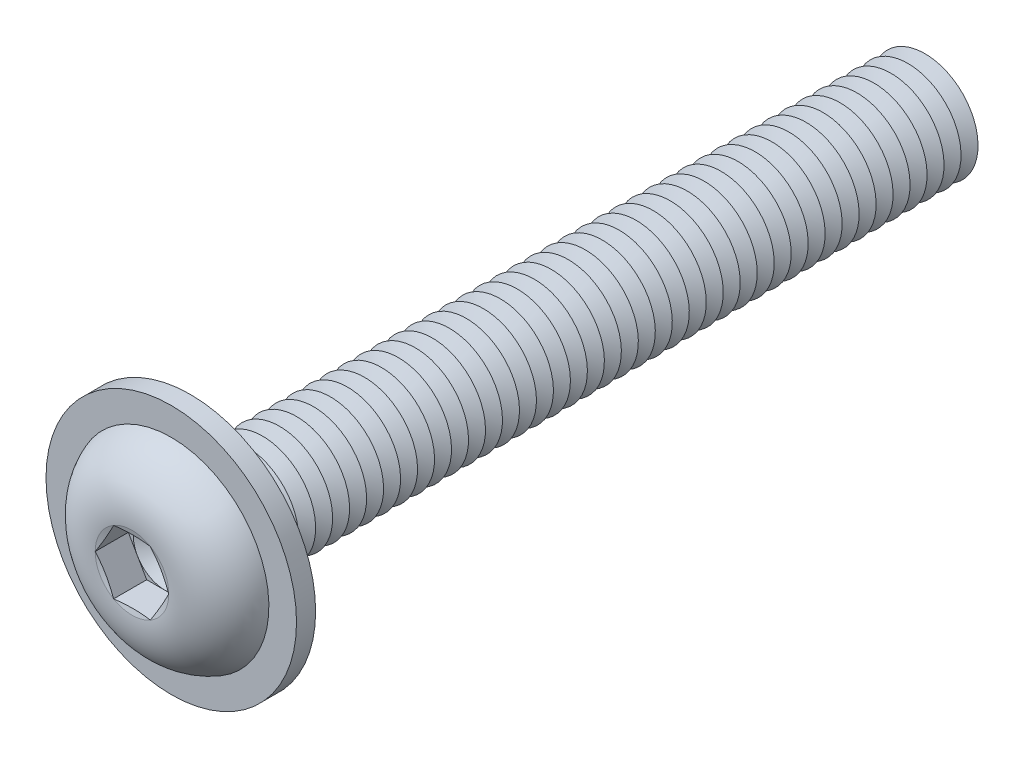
SolidWorks part; units mm, degrees
ref_plane "Front Plane" through (0, 0, 0) normal (0, 0, 1) x (1, 0, 0)
ref_plane "Top Plane" through (0, 0, 0) normal (0, 1, 0) x (1, 0, 0)
ref_plane "Right Plane" through (0, 0, 0) normal (1, 0, 0) x (0, 0, -1)
sketch "Sketch1" plane through (0, 0, 0) normal (1, 0, 0) x (0, 0, -1)
  line L0 (0, 2.5) -> (0, 4.75)
  line L3 (0, 2.5) -> (35, 2.5)
  line L4 (35, 2.5) -> (35, 0)
  line L5 (35, 0) -> (-2.75, 0) construction
  line L6 (-2.75, 0) -> (35, 0)
  line L7 (-2.75, 1.732) -> (-2.75, 0.866) construction
  line L8 (-2.75, 0.866) -> (-2.75, 0)
  line L9 (-2.75, 1.732) -> (-2.5179, 0.866)
  line L10 (-2.5179, 0.866) -> (-2.75, 0.866)
  line L11 (35, 0) -> (22.7481, 0) construction
  line L12 (0, 4.75) -> (-2.75, 4.75) construction
  arc A1 (0, 4.75) -> (-2.75, 1.732) centre (0, 1.9881) ccw
  point P8 (35, 1.25)
  dimension "D1" = 9.5
  dimension "D2" = 5
  dimension "D3" = 2.75
  dimension "D4" = 3.4641
  dimension "D5" = 35
  dimension "D6" = 15
revolve "Revolve1" add sketch "Sketch1" angle 360 about L5
fillet "Fillet1" radius 0.4 1 edges at (0, 2.5, 0)
sketch "Sketch2" plane through (0, 0, 0) normal (1, 0, 0) x (0, 0, -1)
  line L0 (34.6, 2.5) -> (35.4, 2.5)
  line L1 (35, 2.5) -> (0.4, 2.5) construction
  line L2 (35.4, 2.5) -> (35, 1.8072)
  line L3 (35, -2.5) -> (35, 2.5) construction
  line L4 (35, 1.8072) -> (34.6, 2.5)
  dimension "D1" = 0.8
revolve "Cut-Revolve1" cut sketch "Sketch2" angle 360 about axis through (0, 0, -35) along (0, 0, -1)
pattern_linear "LPattern1" count 43 spacing 0.8 along (0, 0, 1) of "Cut-Revolve1"
sketch "Sketch3" plane through (0, 0, 2.75) normal (0, 0, 1) x (1, 0, 0)
  line L7 (0.866, 1.5) -> (-0.866, 1.5)
  line L8 (-0.866, 1.5) -> (-1.7321, 0)
  line L9 (-1.7321, 0) -> (-0.866, -1.5)
  line L10 (-0.866, -1.5) -> (0.866, -1.5)
  line L11 (0.866, -1.5) -> (1.732, 0)
  line L12 (1.732, 0) -> (0.866, 1.5)
  circle A0 centre (0, 0) radius 1.5 construction
  circle A3 centre (0, 0) radius 1.7321 construction
extrude "Cut-Extrude1" cut sketch "Sketch3" against normal blind 1.56
sketch "Sketch4" plane through (0, 0, 1.19) normal (0, 0, 1) x (1, 0, 0)
  line L1 (0.866, 1.5) -> (-0.866, 1.5) construction
  circle A0 centre (0, 0) radius 1.5
extrude "Cut-Extrude2" cut sketch "Sketch4" against normal through all draft 60
sketch "Sketch5" plane through (0, 0, 0) normal (0, 0, -1) x (-1, 0, 0)
  circle A0 centre (0, 0) radius 5.9
  circle A1 centre (0, 0) radius 2.9
  circle A2 centre (0, 0) radius 2.9 construction
  dimension "D1" = 11.8
extrude "Boss-Extrude1" add sketch "Sketch5" against normal blind 0.9
